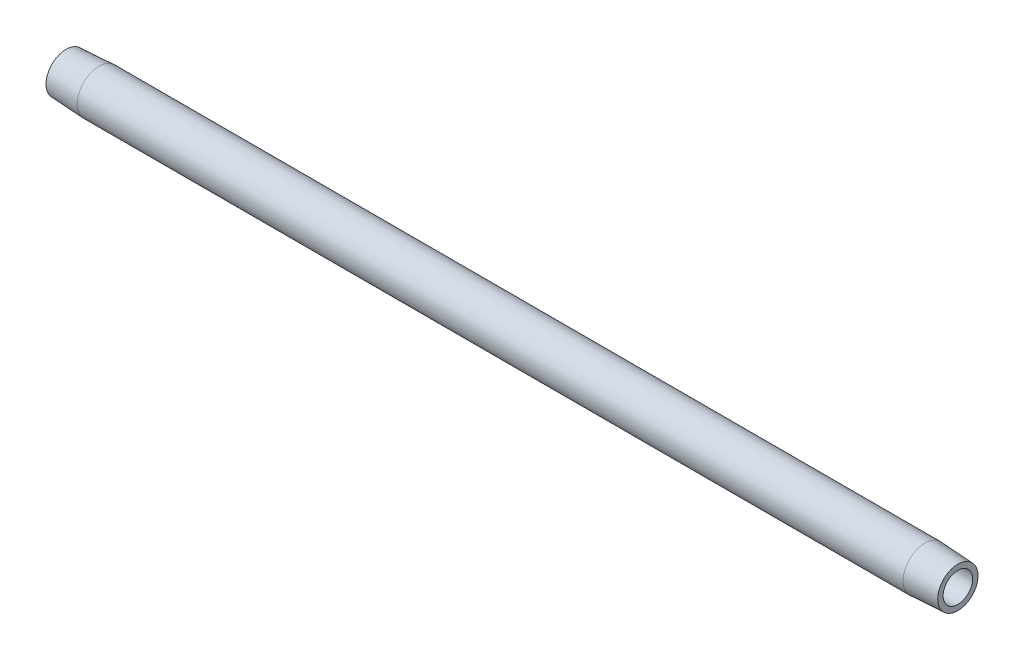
SolidWorks part; units mm, degrees
ref_plane "Front Plane" through (0, 0, 0) normal (0, 0, 1) x (1, 0, 0)
ref_plane "Top Plane" through (0, 0, 0) normal (0, 1, 0) x (1, 0, 0)
ref_plane "Right Plane" through (0, 0, 0) normal (1, 0, 0) x (0, 0, -1)
sketch "Sketch1" plane through (0, 0, 0) normal (0, 1, 0) x (1, 0, 0)
  line L6 (279.4, 4.6228) -> (0, 4.6228)
  line L7 (10.3124, 6.858) -> (0, 6.3175)
  line L8 (0, 6.3175) -> (0, 4.6228)
  line L9 (269.0876, 6.858) -> (10.3124, 6.858)
  line L10 (279.4, 6.3175) -> (269.0876, 6.858)
  line L11 (279.4, 4.6228) -> (279.4, 6.3175)
  line L12 (-6.376, 0) -> (49993.624, 0) construction
  dimension "D1" = 9.2456
  dimension "D2" = 13.716
  dimension "D3" = 3
  dimension "D4" = 3
  dimension "D5" = 279.4
  dimension "D6" = 10.3124
  dimension "D7" = 10.3124
revolve "Revolve1" add sketch "Sketch1" angle 360 about L12
